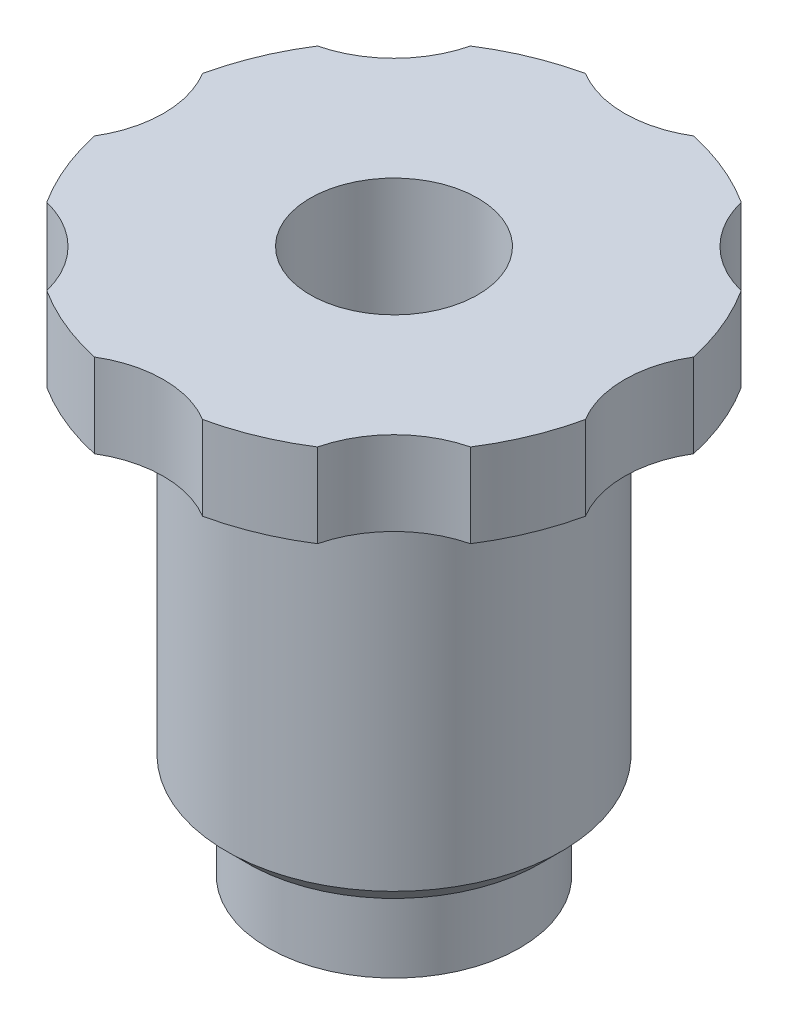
SolidWorks part; units mm, degrees
ref_plane "Face" through (0, 0, 0) normal (0, 0, 1) x (1, 0, 0)
ref_plane "Dessus" through (0, 0, 0) normal (0, 1, 0) x (1, 0, 0)
ref_plane "Droite" through (0, 0, 0) normal (1, 0, 0) x (0, 0, -1)
sketch "Esquisse1" plane through (0, 0, 0) normal (0, 0, 1) x (1, 0, 0)
  line L0 (0, 0) -> (0, 62.8898) construction
  line L1 (0, 0) -> (3, 0)
  line L2 (3, 0) -> (3, 2)
  line L3 (3, 2) -> (4, 2)
  line L4 (4, 2) -> (4, 10)
  line L5 (4, 10) -> (3.5, 10)
  line L6 (3.5, 10) -> (3.5, 11)
  line L7 (3.5, 11) -> (6, 11)
  line L8 (6, 11) -> (6, 13)
  line L9 (6, 13) -> (0, 13)
  line L10 (0, 13) -> (0, 0)
  dimension "D1" = 3
  dimension "D2" = 4
  dimension "D3" = 2
  dimension "D4" = 8
  dimension "D5" = 0.5
  dimension "D6" = 1
  dimension "D7" = 6
  dimension "D8" = 2
revolve "Révolution1" add sketch "Esquisse1" angle 360 about L0
sketch "Esquisse2" plane through (0, 0, 0) normal (0, -1, 0) x (1, 0, 0)
  circle A0 centre (0, 0) radius 2
  dimension "D1" = 4
extrude "Enlèv. mat.-Extru.1" cut sketch "Esquisse2" against normal through all
chamfer "Chanfrein1" distance 0.5 angle 45 1 edges at (0, 2, -4)
sketch "Esquisse3" plane through (0, 13, 0) normal (0, 1, 0) x (-1, 0, 0)
  line L0 (0, 0) -> (-8, 0) construction
  circle A0 centre (-8, 0) radius 2.5
  dimension "D2" = 5
  dimension "D1" = 8
extrude "Enlèv. mat.-Extru.2" cut sketch "Esquisse3" against normal through all
pattern_circular "Répétition circulaire1" count 8 over 360 about axis through (0, 0, 0) along (0, 1, 0) of "Enlèv. mat.-Extru.2"
